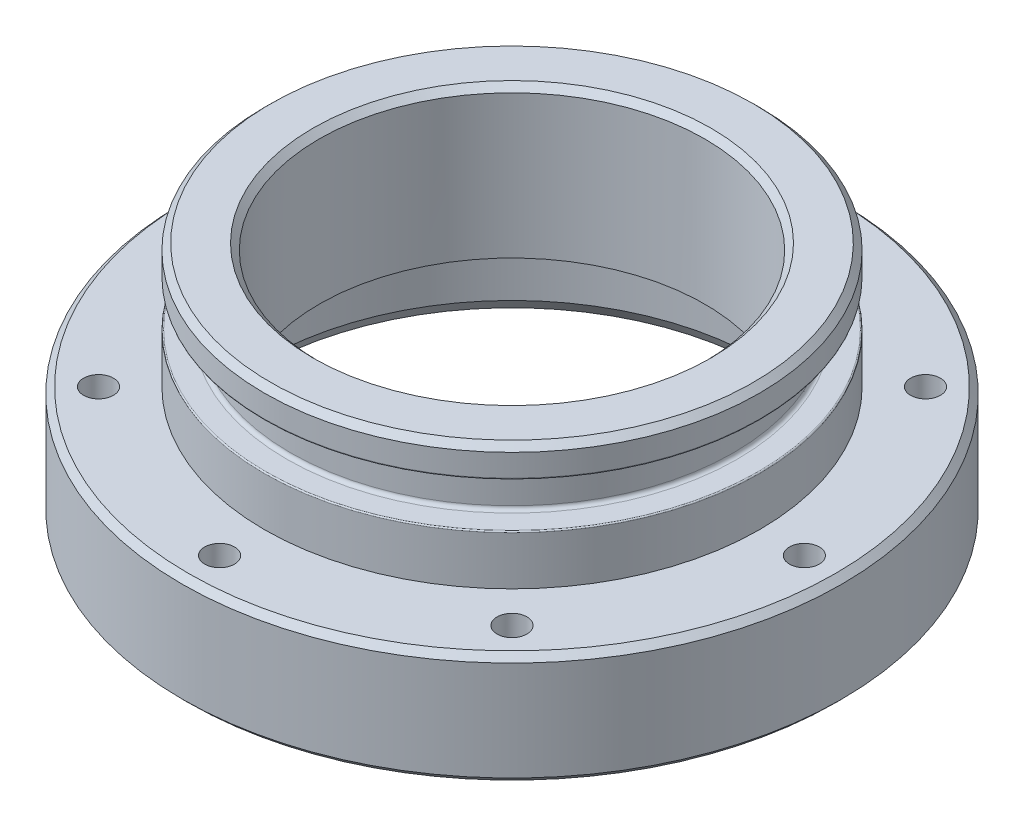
SolidWorks part; units mm, degrees
ref_plane "Plan1" through (0, 0, 0) normal (0, 0, 1) x (1, 0, 0)
ref_plane "Plan2" through (0, 0, 0) normal (0, 1, 0) x (1, 0, 0)
ref_plane "Plan3" through (0, 0, 0) normal (1, 0, 0) x (0, 0, -1)
sketch "Esquisse1" plane through (0, 0, 0) normal (0, 0, 1) x (1, 0, 0)
  line L0 (0, 15.0015) -> (0, -5.6367) construction
  line L1 (0, -55) -> (0, 55) construction
  line L2 (15.5, 19) -> (15.5, 7)
  line L3 (15.5, 7) -> (20, 7)
  line L4 (20, 7) -> (20, 0.866)
  line L5 (20.5, 0) -> (26.5, 0)
  line L6 (26.5, 0) -> (26.5, 9)
  line L7 (26.5, 9) -> (19.9, 9)
  line L8 (19.9, 9) -> (19.9, 13)
  line L9 (19.9, 19) -> (15.5, 19)
  line L10 (19.9, 13) -> (18.1, 13)
  line L11 (17.8, 13.3) -> (17.8, 16.3)
  line L12 (18.1, 16.6) -> (19.9, 16.6)
  line L13 (19.9, 16.6) -> (19.9, 19)
  line L14 (20, 0.866) -> (20.5, 0)
  circle A0 centre (18.605, 14.31) radius 1.31 construction
  arc A1 (18.1, 16.6) -> (17.8, 16.3) centre (18.1, 16.3) ccw
  arc A2 (17.8, 13.3) -> (18.1, 13) centre (18.1, 13.3) ccw
  dimension "D8" = 2.62
  dimension "D12" = 34.59
  dimension "D13" = 0.3
  dimension "D1" = 31
  dimension "D2" = 40
  dimension "D3" = 39.8
  dimension "D4" = 53
  dimension "D5" = 7
  dimension "D6" = 10
  dimension "D7" = 2
  dimension "D9" = 2.1
  dimension "D10" = 3.6
  dimension "D11" = 4
  dimension "D14" = 30
  dimension "D15" = 0.5
revolve "Révolution1" add sketch "Esquisse1" angle 360 about L0
hole_wizard "Chambrage pour vis à tête hexagonale M21" positions "Esquisse3" profile "Esquisse2" counterbore size "M2" standard "ISO"
sketch "Esquisse3" plane through (0, 0, 0) normal (0, -1, 0) x (-1, 0, 0)
  line L0 (0, 55) -> (0, -55) construction
  circle A0 centre (0, 0) radius 23.5
  point P0 (0, -23.5)
  dimension "D1" = 47
sketch "Esquisse2" plane through (0, 0, 23.5) normal (1, 0, 0) x (0, 0, -1)
  line L0 (0, 0) -> (0, 19)
  line L1 (0, 19) -> (1.2, 19)
  line L3 (1.2, 19) -> (1.2, 2.4)
  line L4 (1.2, 2.4) -> (2.2, 2.4)
  line L5 (2.2, 2.4) -> (2.2, 0)
  line L7 (2.2, 0) -> (0, 0)
  line L11 (0, -6.35) -> (0, 107.95) construction
  dimension "Diamètre du perçage jusqu'au prochain" = 2.4
  dimension "Profondeur du perçage jusqu'au prochain" = 19
  dimension "Diamètre du chambrage" = 4.4
  dimension "Profondeur du chambrage" = 2.4
sketch "Esquisse4" plane through (0, 0, 0) normal (0, 0, 1) x (1, 0, 0)
  line L0 (0, 15.0015) -> (0, -5.6367) construction
  line L1 (0, 15.0015) -> (0, -5.6367) construction
  circle A0 centre (18.605, 14.31) radius 1.31 construction
  circle A1 centre (18.605, 14.31) radius 1.31
  dimension "D1" = 2.62
  dimension "D2" = 34.59
revolve "Révolution2" add sketch "Esquisse4" angle 360 about L1
chamfer "Chanfrein1" distance 0.5 angle 45 2 edges at (0, 19, 15.5) (0, 19, 19.9)
chamfer "Chanfrein2" distance 0.5 angle 45 2 edges at (0, 9, 26.5) (0, 0, 26.5)
pattern_circular "Répétition circulaire1" count 8 over 360 about axis through (0, 0, 0) along (0, 1, 0) of "Chambrage pour vis à tête hexagonale M21"
delete or keep bodies "Corps-Effacer/suppr1" type delete bodies bodies 103
fillet "Congé1" radius 0.1 2 edges at (0, 16.6, 19.9) (0, 13, 19.9)
fillet "Congé2" radius 0.3 1 edges at (0, 7, 20)
